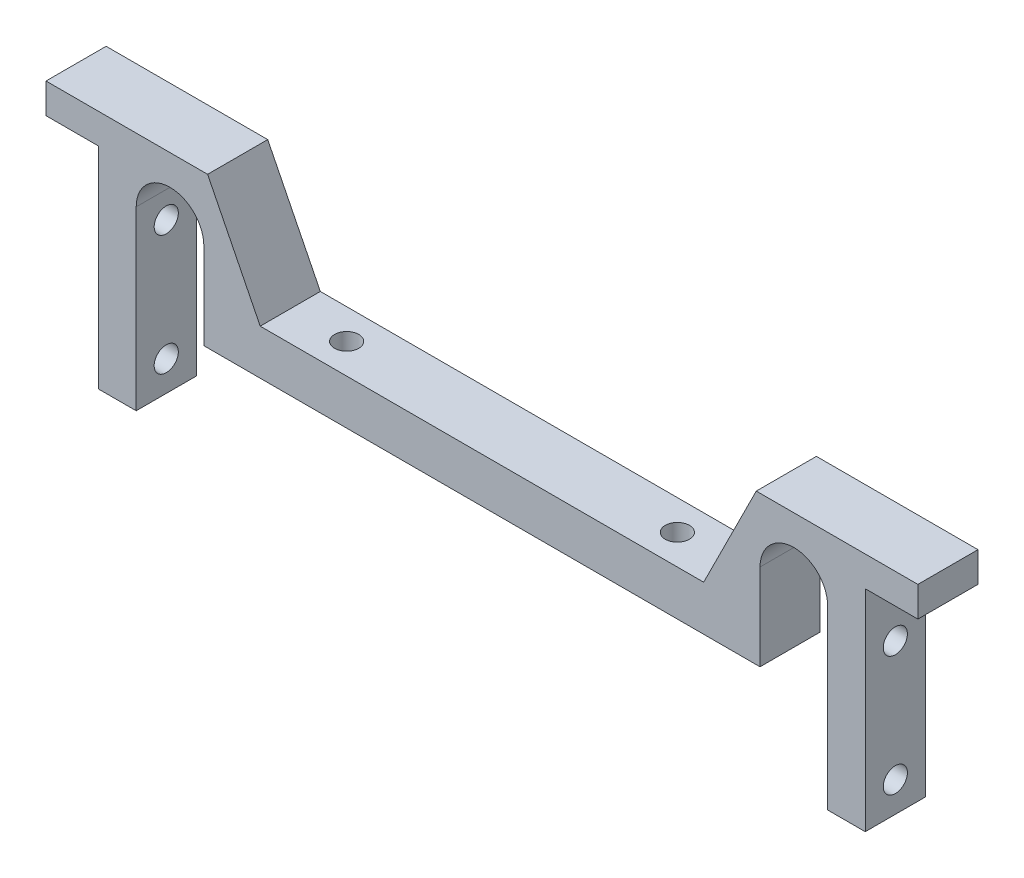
SolidWorks part; units mm, degrees
ref_plane "Front Plane" through (0, 0, 0) normal (0, 0, 1) x (1, 0, 0)
ref_plane "Top Plane" through (0, 0, 0) normal (0, 1, 0) x (1, 0, 0)
ref_plane "Right Plane" through (0, 0, 0) normal (1, 0, 0) x (0, 0, -1)
sketch "Sketch1" plane through (0, 0, 0) normal (0, 0, 1) x (1, 0, 0)
  line L0 (-58.7375, 0) -> (58.7375, 0)
  line L1 (-92.075, 25.4) -> (-80.9625, 25.4)
  line L2 (0, 25.4) -> (0, 0) construction
  line L3 (58.7375, 0) -> (58.7375, 18.2563)
  line L4 (73.025, 18.2563) -> (73.025, -19.05)
  line L5 (73.025, -19.05) -> (80.9625, -19.05)
  line L6 (80.9625, -19.05) -> (80.9625, 25.4)
  line L7 (92.075, 25.4) -> (92.075, 31.75)
  line L8 (-92.075, 25.4) -> (-92.075, 31.75)
  line L9 (-73.025, -19.05) -> (-80.9625, -19.05)
  line L10 (-80.9625, -19.05) -> (-80.9625, 25.4)
  line L11 (-73.025, 18.2562) -> (-73.025, -19.05)
  line L12 (-58.7375, 0) -> (-58.7375, 18.2562)
  line L13 (-92.075, 31.75) -> (-57.9438, 31.75)
  line L14 (80.9625, 25.4) -> (92.075, 25.4)
  line L15 (-57.9438, 31.75) -> (-46.8313, 9.525)
  line L16 (-46.8313, 9.525) -> (46.8313, 9.525)
  line L17 (46.8313, 9.525) -> (57.9438, 31.75)
  line L18 (0, 9.525) -> (0, 0) construction
  line L19 (57.9438, 31.75) -> (92.075, 31.75)
  arc A0 (58.7375, 18.2563) -> (73.025, 18.2563) centre (65.8813, 18.2562) cw
  arc A1 (-58.7375, 18.2562) -> (-73.025, 18.2562) centre (-65.8813, 18.2562) ccw
  point P4 (0, 0)
  dimension "D8" = 6.35
  dimension "D1" = 25.4
  dimension "D2" = 6.35
  dimension "D3" = 161.925
  dimension "D4" = 146.05
  dimension "D5" = 117.475
  dimension "D6" = 18.2562
  dimension "D7" = 7.9375
  dimension "D9" = 44.45
  dimension "D10" = 184.15
  dimension "D11" = 9.525
  dimension "D12" = 93.6625
  dimension "D13" = 115.8875
extrude "Boss-Extrude1" add sketch "Sketch1" along normal mid plane 12.7
hole_wizard "#10 Clearance Hole1" positions "Sketch3" profile "Sketch2" hole size "#10" standard "Ansi Inch"
sketch "Sketch3" plane through (80.9625, 0, 0) normal (1, 0, 0) x (0, 0, -1)
  line L0 (-6.35, 25.4) -> (6.35, 25.4) construction
  point P0 (0, 12.7)
  point P1 (0, -12.7)
  dimension "D1" = 12.7
  dimension "D2" = 25.4
sketch "Sketch2" plane through (80.9625, 12.7, 0) normal (0, 1, 0) x (0, 0, -1)
  line L0 (0, 0) -> (0, 32.5437)
  line L1 (0, 32.5437) -> (2.5527, 32.5437)
  line L2 (2.5527, 32.5437) -> (2.5527, 0)
  line L5 (2.5527, 0) -> (0, 0)
  line L11 (0, -6.35) -> (0, 107.95) construction
  dimension "Thru Hole Dia." = 5.1054
  dimension "Thru Hole Depth" = 32.5437
mirror "Mirror1" about plane through (0, 0, 0) normal (1, 0, 0) of "#10 Clearance Hole1"
hole_wizard "#10 Clearance Hole2" positions "Sketch5" profile "Sketch4" hole size "#10" standard "Ansi Inch"
sketch "Sketch5" plane through (0, 9.525, 0) normal (0, 1, 0) x (-1, 0, 0)
  point P0 (34.925, 0)
  point P1 (-34.925, 0)
  dimension "D1" = 34.925
  dimension "D2" = 34.925
sketch "Sketch4" plane through (-34.925, 9.525, 0) normal (1, 0, 0) x (0, 0, 1)
  line L0 (0, 0) -> (0, 28.575)
  line L1 (0, 28.575) -> (2.5527, 28.575)
  line L2 (2.5527, 28.575) -> (2.5527, 0)
  line L5 (2.5527, 0) -> (0, 0)
  line L11 (0, -6.35) -> (0, 107.95) construction
  dimension "Thru Hole Dia." = 5.1054
  dimension "Thru Hole Depth" = 28.575
equation "\"Buoyancy\"=\"SW-Volume\"*(\"SW-Density\"-.037062)"
